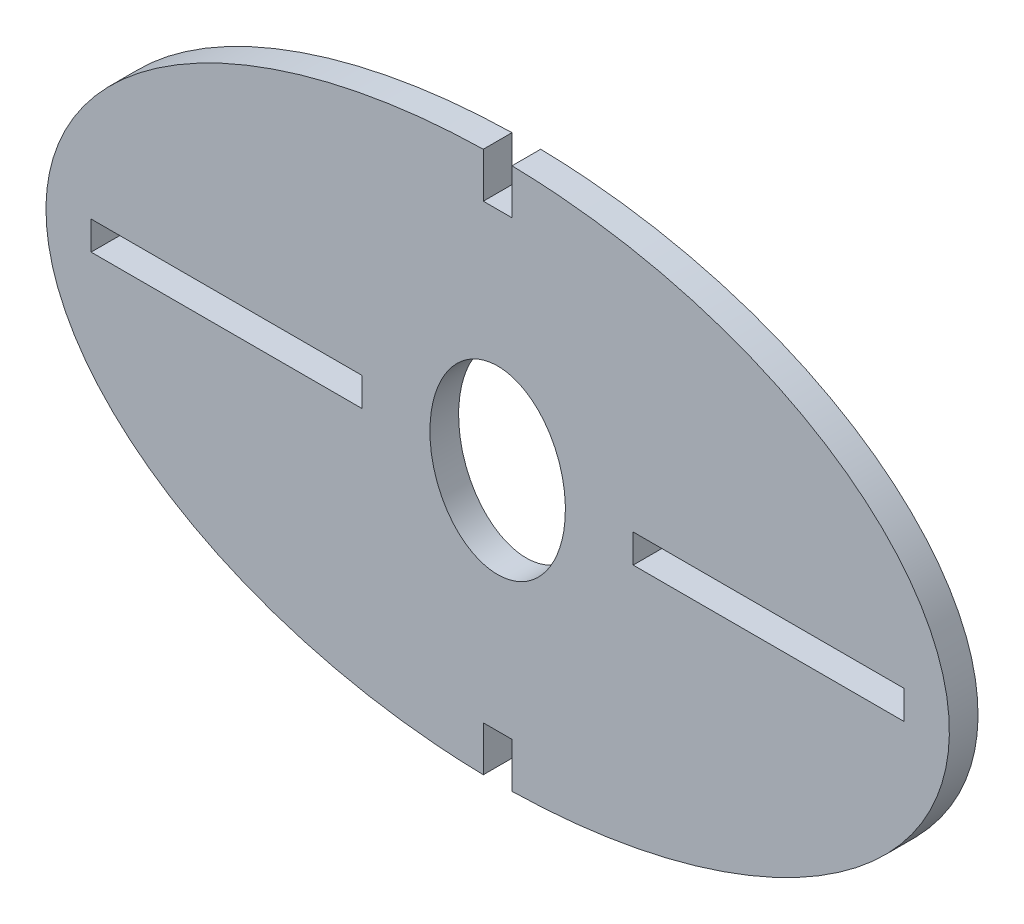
SolidWorks part; units mm, degrees
ref_plane "Front Plane" through (0, 0, 0) normal (0, 0, 1) x (1, 0, 0)
ref_plane "Top Plane" through (0, 0, 0) normal (0, 1, 0) x (1, 0, 0)
ref_plane "Right Plane" through (0, 0, 0) normal (1, 0, 0) x (0, 0, -1)
sketch "Sketch1" plane through (0, 0, 0) normal (0, 0, 1) x (1, 0, 0)
  line L2 (0, 0) -> (-15, 0) construction
  line L3 (0, 0) -> (15, 0) construction
  line L4 (-15, 1.5875) -> (-15, -1.5875)
  line L5 (-15, 1.5875) -> (-45, 1.5875)
  line L6 (-45, 1.5875) -> (-45, -1.5875)
  line L7 (-45, -1.5875) -> (-15, -1.5875)
  line L8 (45, 1.5875) -> (45, -1.5875)
  line L9 (45, -1.5875) -> (15, -1.5875)
  line L10 (15, 1.5875) -> (15, -1.5875)
  line L11 (15, 1.5875) -> (45, 1.5875)
  ellipse E0 centre (0, 0) end of major axis (-50, 0) minor radius 30
  ellipse E1 centre (0, 0) end of major axis (0, -10) minor radius 7.5
extrude "Boss-Extrude1" add sketch "Sketch1" along normal blind 3.175
sketch "Sketch2" plane through (0, 0, 3.175) normal (0, 0, 1) x (1, 0, 0)
  line L0 (0, 0) -> (0, 25) construction
  line L1 (0, 0) -> (-24.2236, 0) construction
  line L2 (0, 25) -> (-1.5875, 25)
  line L3 (-1.5875, 25) -> (-1.5875, 47.4535)
  line L4 (-1.5875, 47.4535) -> (1.5875, 47.4535)
  line L5 (1.5875, 47.4535) -> (1.5875, 25)
  line L6 (1.5875, 25) -> (0, 25)
  line L7 (-1.5875, -47.4535) -> (1.5875, -47.4535)
  line L8 (1.5875, -47.4535) -> (1.5875, -25)
  line L9 (-1.5875, -25) -> (-1.5875, -47.4535)
  line L10 (0, -25) -> (-1.5875, -25)
  line L11 (1.5875, -25) -> (0, -25)
extrude "Cut-Extrude1" cut sketch "Sketch2" against normal blind 10
